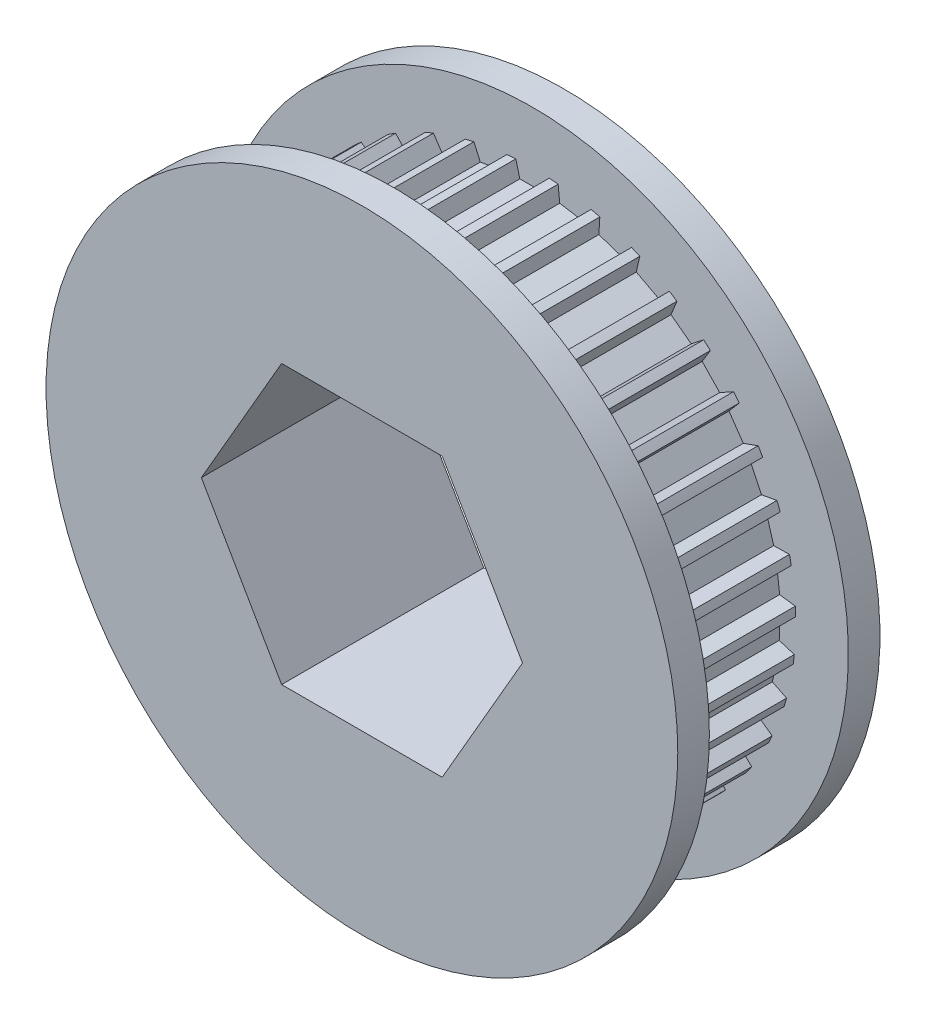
SolidWorks part; units mm, degrees
ref_plane "Front Plane" through (0, 0, 0) normal (0, 0, 1) x (1, 0, 0)
ref_plane "Top Plane" through (0, 0, 0) normal (0, 1, 0) x (1, 0, 0)
ref_plane "Right Plane" through (0, 0, 0) normal (1, 0, 0) x (0, 0, -1)
sketch "Sketch1" plane through (0, 0, 0) normal (0, 0, 1) x (1, 0, 0)
  circle A0 centre (0, 0) radius 12.5
  dimension "D1" = 25
extrude "Boss-Extrude1" add sketch "Sketch1" along normal mid plane 6.6
sketch "Sketch3" plane through (0, 0, 3.3) normal (0, 0, 1) x (1, 0, 0)
  circle A0 centre (0, 0) radius 15
  dimension "D1" = 30
sketch "Sketch2" plane through (0, 0, -3.3) normal (0, 0, -1) x (-1, 0, 0)
  circle A0 centre (0, 0) radius 15
  dimension "D1" = 30
sketch "Sketch4" plane through (0, 0, 3.3) normal (0, 0, 1) x (1, 0, 0)
  line L0 (-0.6, 11.75) -> (0.6, 11.75)
  line L1 (0.6, 11.75) -> (0.8, 12.5)
  line L2 (0.8, 12.5) -> (-0.8, 12.5)
  line L3 (-0.8, 12.5) -> (-0.6, 11.75)
  circle A0 centre (0, 0) radius 12.5 construction
  point P10 (0, 11.75)
  dimension "D1" = 1.2
  dimension "D2" = 1.6
  dimension "D3" = 0.75
extrude "Cut-Extrude1" cut sketch "Sketch4" against normal up to surface (6.6 mm away) and the other way through all
pattern_circular "CirPattern2" count 39 over 360 about axis through (0, 0, 0) along (0, 0, 1) of "Cut-Extrude1"
extrude "Boss-Extrude3" add sketch "Sketch2" along normal blind 1.5
extrude "Boss-Extrude4" add sketch "Sketch3" along normal blind 1.5 contours A0
sketch "Sketch5" plane through (0, 0, 4.8) normal (0, 0, 1) x (1, 0, 0)
  line L1 (7.625, 0) -> (3.8125, 6.6034)
  line L2 (3.8125, 6.6034) -> (-3.8125, 6.6034)
  line L3 (-3.8125, 6.6034) -> (-7.625, 0)
  line L4 (-7.625, 0) -> (-3.8125, -6.6034)
  line L5 (-3.8125, -6.6034) -> (3.8125, -6.6034)
  line L6 (3.8125, -6.6034) -> (7.625, 0)
  circle A0 centre (0, 0) radius 6.6034 construction
  dimension "D1" = 15.25
extrude "Cut-Extrude2" cut sketch "Sketch5" against normal through all both and the other way through all
